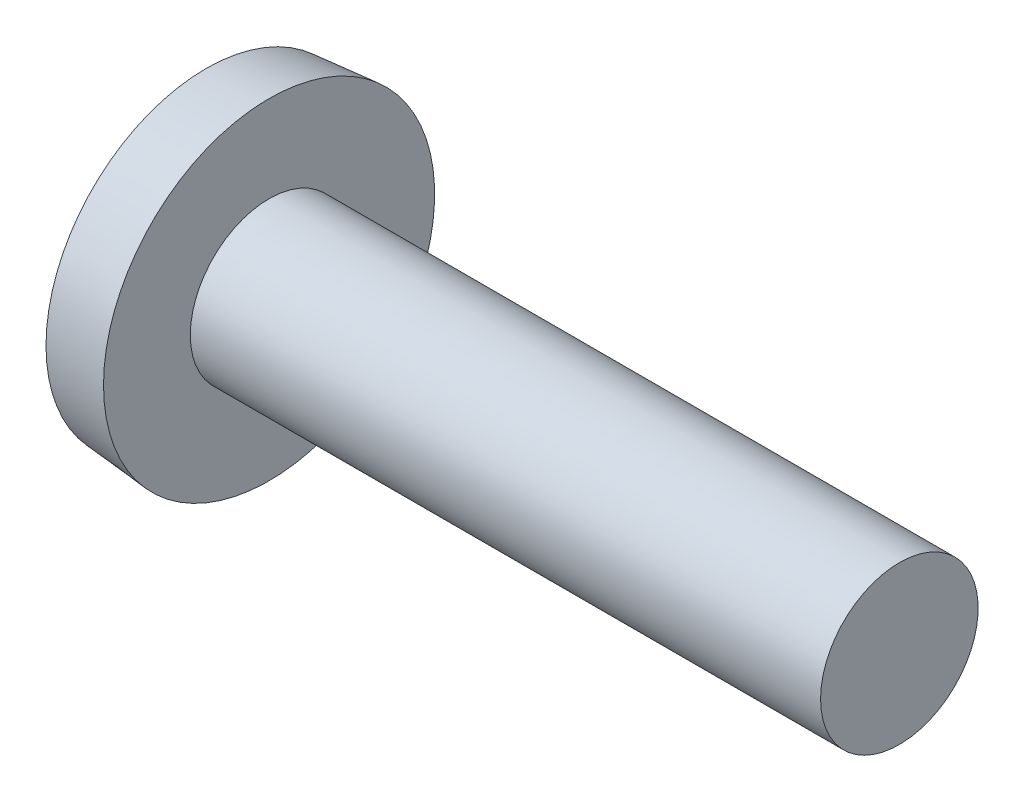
SolidWorks part; units mm, degrees
ref_plane "Plane1" through (0, 0, 0) normal (0, 0, 1) x (1, 0, 0)
ref_plane "Plane2" through (0, 0, 0) normal (0, 1, 0) x (1, 0, 0)
ref_plane "Plane3" through (0, 0, 0) normal (1, 0, 0) x (0, 0, -1)
sketch "BodySke" plane through (0, 0, 0) normal (0, 0, 1) x (1, 0, 0)
  line L0 (6.1976, 4.7625) -> (6.1976, 10.0076)
  line L1 (6.1976, 10.0076) -> (2.3876, 9.6743)
  line L2 (-25.4, 0) -> (127, 0) construction
  line L3 (6.1976, -10.0076) -> (2.3876, -9.6743) construction
  line L4 (6.1976, 4.7625) -> (44.2976, 4.7625)
  line L5 (44.2976, 4.7625) -> (44.2976, 0)
  line L6 (44.2976, 0) -> (0, 0)
  line L7 (6.1976, -4.7625) -> (44.2976, -4.7625) construction
  line L8 (7.2568, 6.35) -> (7.2568, -3.175) construction
  line L9 (37.9476, 6.35) -> (37.9476, -3.175) construction
  arc A0 (0, 0) -> (2.3876, 9.6743) centre (20.7933, 0) cw
revolve "Base-Revolve" add sketch "BodySke" angle 360 about L2
sketch "Sketch2" plane through (0, 0, 0) normal (1, 0, 0) x (0, 0, -1)
  line L0 (10.0076, -0.8509) -> (10.0076, 0.8509)
  line L1 (10.0076, 0.8509) -> (-10.0076, 0.8509)
  line L2 (-10.0076, 0.8509) -> (-10.0076, -0.8509)
  line L3 (-10.0076, -0.8509) -> (10.0076, -0.8509)
extrude "Slot" cut sketch "Sketch2" along normal blind 2.2606
sketch "Sketch3" plane through (0, 0, 0) normal (1, 0, 0) x (0, 0, -1)
  line L0 (-1.0287, 6.096) -> (1.0287, 6.096)
  line L1 (1.0287, 6.096) -> (1.0287, -6.096)
  line L2 (1.0287, -6.096) -> (-1.0287, -6.096)
  line L3 (-1.0287, -6.096) -> (-1.0287, 6.096)
ref_plane "Plane4" through (4.3434, 0, 0) normal (1, 0, 0) x (0, 0, -1)
sketch "Sketch4" plane through (4.3434, 0, 0) normal (1, 0, 0) x (0, 0, -1)
  line L0 (-0.5143, 0.5143) -> (0.5143, 0.5143)
  line L1 (0.5143, 0.5143) -> (0.5144, -0.5143)
  line L2 (0.5144, -0.5143) -> (-0.5143, -0.5144)
  line L3 (-0.5143, -0.5144) -> (-0.5143, 0.5143)
loft "Cross" cut profiles "Sketch3", "Sketch4"
pattern_circular "CirPattern1" count 2 every 90 about axis through (0, 0, 0) along (1, 0, 0) of "Cross"
sketch "ThdSchSke" plane through (0, 0, 0) normal (0, 0, 1) x (1, 0, 0)
  line L0 (37.9476, -2.1133) -> (36.0926, -4.7625)
  line L1 (37.9476, -2.1133) -> (39.8026, -4.7625)
  line L2 (39.8026, -4.7625) -> (39.8026, -5.9531)
  line L3 (-3.175, 0) -> (5.1513, 0) construction
  line L5 (39.8026, -5.9531) -> (36.0926, -5.9531)
  line L6 (36.0926, -5.9531) -> (36.0926, -4.7625)
revolve "ThreadSchematic" [suppressed] cut sketch "ThdSchSke" angle 360 about L3
pattern_linear "ThdSchPat" [suppressed]
equation "\"D1@Sketch3\" = \"Cross_width@Sketch3\" / 2"
equation "\"D2@Sketch3\" = \"Cross_dia@Sketch3\" / 2"
equation "\"D1@Sketch4\" = \"Cross_width@Sketch3\"*.5"
equation "\"D2@Sketch4\" = \"D1@Sketch4\" / 2"
equation "\"D3@Sketch4\" = \"D1@Sketch4\""
equation "\"D4@Sketch4\" = \"D2@Sketch4\""
equation "\"D1@Sketch2\" = \"Head_dia@BodySke\""
equation "\"D2@Sketch2\" = \"D1@Sketch2\" / 2"
equation "\"D3@Sketch2\" = \"Slot_width@Sketch2\" / 2"
equation "\"Thread_length@ThreadCosmetic\" = ((sgn( (\"Length@BodySke\" - \"Advance@BodySke\" ) - \"Thread_nom@BodySke\" )-1)*( (\"Length@BodySke\" - \"Advance@BodySke\" ) - \"Thread_nom@BodySke\" ))/-2+ \"Thread_nom@BodySke\""
equation "\"Thread_minor@ThdSchSke\" = \"Thread_minor@ThreadCosmetic\""
equation "\"Diameter@ThdSchSke\" = \"Diameter@BodySke\""
equation "\"Overcut@ThdSchSke\" = \"Diameter@BodySke\" * 1.25"
equation "\"Start@ThdSchSke\" = \"Head_ht@BodySke\" + \"Length@BodySke\" - \"Thread_length@ThreadCosmetic\"  '---Non-countersunk---"
equation "\"Num_threads@ThdSchPat\" = int( \"Thread_length@ThreadCosmetic\" / \"Advance@BodySke\" + 0.999 )  + 1"
equation "\"Advance@ThdSchPat\" = \"Thread_length@ThreadCosmetic\" /  (\"Num_threads@ThdSchPat\" - 1) 'relax it"
